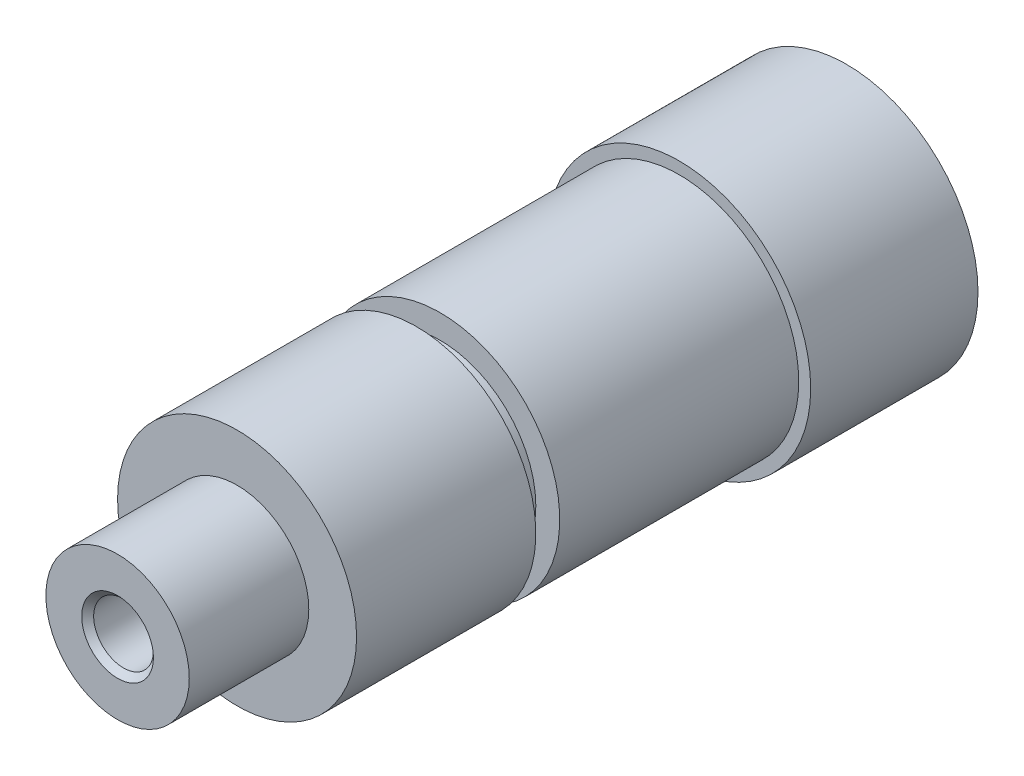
SolidWorks part; units mm, degrees
ref_plane "Face" through (0, 0, 0) normal (0, 0, 1) x (1, 0, 0)
ref_plane "Dessus" through (0, 0, 0) normal (0, 1, 0) x (1, 0, 0)
ref_plane "Droite" through (0, 0, 0) normal (1, 0, 0) x (0, 0, -1)
sketch "Esquisse1" plane through (0, 0, 0) normal (0, 0, 1) x (1, 0, 0)
  circle A0 centre (0, 0) radius 11
  dimension "D1" = 22
extrude "Base-Extrusion" add sketch "Esquisse1" along normal blind 14
sketch "Esquisse2" plane through (0, 0, 14) normal (0, 0, 1) x (1, 0, 0)
  circle A0 centre (0, 0) radius 10
  dimension "D1" = 20
extrude "Boss.-Extru.1" add sketch "Esquisse2" along normal blind 37
sketch "Esquisse3" plane through (0, 0, 0) normal (0, 1, 0) x (1, 0, 0)
  line L0 (10, -34) -> (8, -34)
  line L1 (8, -34) -> (8, -36)
  line L2 (8, -36) -> (10, -36)
  line L3 (10, -36) -> (10, -34)
  line L4 (-11, -14) -> (11, -14) construction
  line L5 (10, -51) -> (10, -14) construction
  line L6 (0, 0) -> (0, -55.4286) construction
  line L7 (0, -14) -> (0, 0) construction
  dimension "D1" = 20
  dimension "D2" = 2
  dimension "D3" = 2
revolve "Enlèvement de matière-Révolution1" cut sketch "Esquisse3" angle 360 about L6
sketch "Esquisse4" plane through (0, 0, 51) normal (0, 0, 1) x (1, 0, 0)
  circle A0 centre (0, 0) radius 6
  dimension "D1" = 12
extrude "Boss.-Extru.2" add sketch "Esquisse4" along normal blind 10
hole_wizard "Trou taraudé M6x1.01" positions "Esquisse6" profile "Esquisse5" tap size "M6x1.0" standard "ISO"
sketch "Esquisse6" plane through (0, 0, 61) normal (0, 0, 1) x (1, 0, 0)
  circle A0 centre (0, 0) radius 6 construction
  point P0 (0, 0)
sketch "Esquisse5" plane through (0, 0, 61) normal (1, 0, 0) x (0, -1, 0)
  line L0 (0, 0) -> (0, 20.5022)
  line L1 (0, 20.5022) -> (2.5, 19)
  line L2 (2.5, 19) -> (2.5, 0.5)
  line L3 (2.5, 0.5) -> (3, 0)
  line L5 (3, 0) -> (0, 0)
  line L6 (-2.5, 0.5) -> (-3, 0) construction
  line L10 (0, 20.5022) -> (-2.5, 19) construction
  line L11 (0, -6.35) -> (0, 107.95) construction
  dimension "Diamètre du perçage" = 5
  dimension "Profondeur du perçage" = 19
  dimension "Diamètre du fraisage entrant" = 6
  dimension "Angle du fraisage entrant" = 90
  dimension "Angle de pointe" = 118
